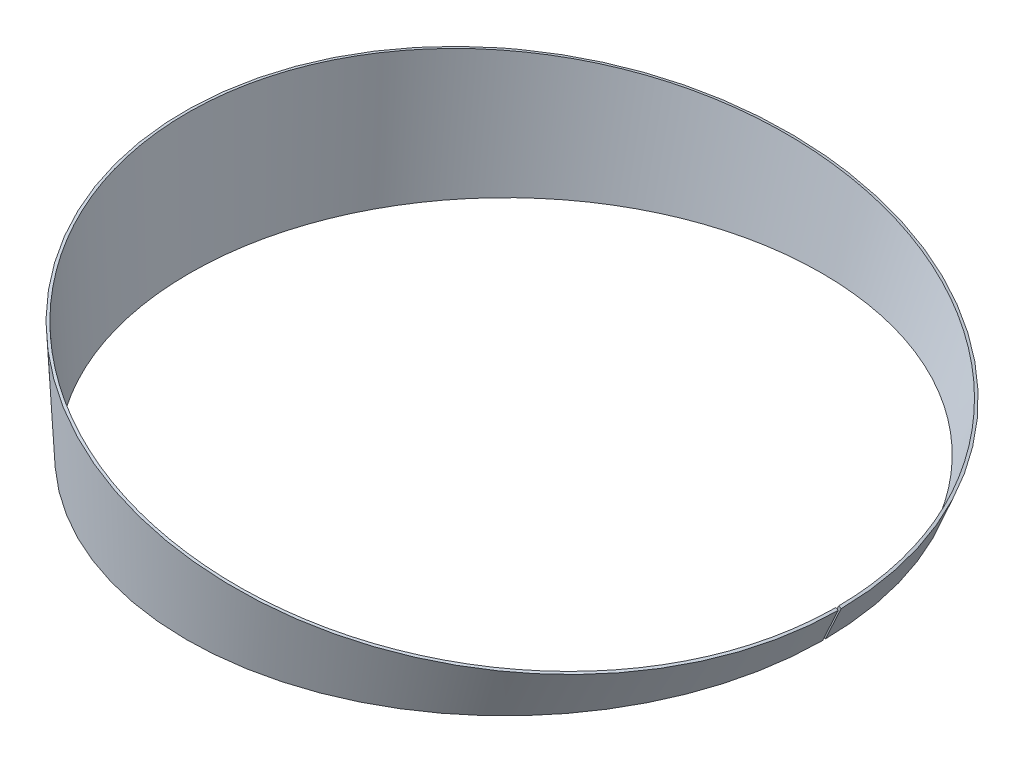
SolidWorks part; units mm, degrees
ref_plane "Ebene vorne" through (0, 0, 0) normal (0, 0, 1) x (1, 0, 0)
ref_plane "Ebene oben" through (0, 0, 0) normal (0, 1, 0) x (1, 0, 0)
ref_plane "Ebene rechts" through (0, 0, 0) normal (1, 0, 0) x (0, 0, -1)
sketch "Skizze1" plane through (0, 0, 0) normal (0, 0, 1) x (1, 0, 0)
  line L0 (0, 0) -> (40, 0) construction
  line L1 (40, 0) -> (0.4925, 6.2574) construction
  arc A0 (0.4925, 6.2574) -> (0, 0) centre (40, 0) ccw
  dimension "D1" = 9
  dimension "D2" = 40
ref_plane "Ebene1" through (0.4925, 6.2574, 0) normal (-0.1564, -0.9877, 0) x (0.9877, -0.1564, 0)
sketch "Skizze2" plane through (0, 0, 0) normal (0, 1, 0) x (1, 0, 0)
  line L0 (23.2098, 0.1013) -> (0, 0) construction
  line L1 (0, 0) -> (23.2098, -0.1013) construction
  line L2 (23.2098, -0.1013) -> (23.2098, 0.1013) construction
  arc A0 (23.2098, 0.1013) -> (23.2098, -0.1013) centre (0, 0) ccw
  dimension "D1" = 46.42
  dimension "D2" = 0.5
sketch "Skizze3" plane through (0.4925, 6.2574, 0) normal (-0.1564, -0.9877, 0) x (0.9877, -0.1564, 0)
  line L0 (24.1563, -0.1054) -> (0, 0) construction
  line L1 (0, 0) -> (24.1563, 0.1054) construction
  line L2 (24.1563, 0.1054) -> (24.1563, -0.1054) construction
  arc A0 (24.1563, 0.1054) -> (24.1563, -0.1054) centre (0, 0) ccw
  dimension "D1" = 48.313
  dimension "D2" = 0.5
sheet metal parameters "Blech1" thickness 0.2 parameters "D1"=2, "Dicke"=0.2
lofted bend "Ausgeformte Biegungen1" parameters "D1"=0, "D12"=0.2
other "Freiform-Biegung1" parameters "D1"=1000, "D4"=57.296, "D5"=1
flat pattern "Abwicklung1"
sketch "Biegung-Linien1" plane through (0, 0, 0) normal (0, 1, 0) x (-1, 0, 0)
other "Abwickeln-<Freiform-Biegung1>1"
